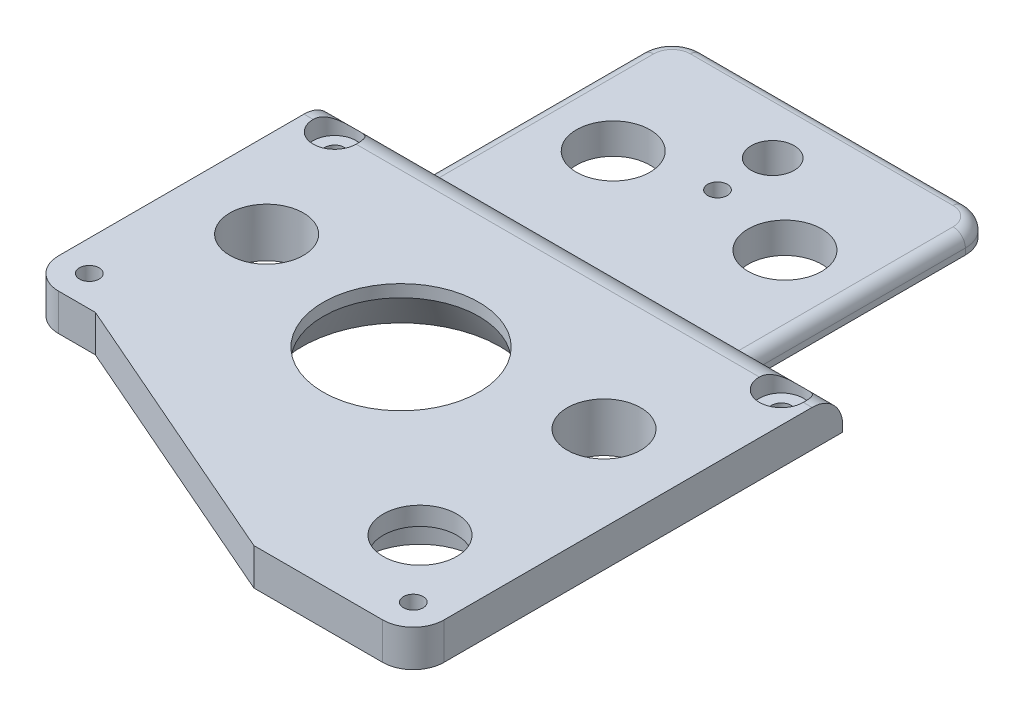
SolidWorks part; units mm, degrees
ref_plane "Спереди" through (0, 0, 0) normal (0, 0, 1) x (1, 0, 0)
ref_plane "Сверху" through (0, 0, 0) normal (0, 1, 0) x (1, 0, 0)
ref_plane "Справа" through (0, 0, 0) normal (1, 0, 0) x (0, 0, -1)
sketch "Sketch1" plane through (0, 0, 0) normal (0, 1, 0) x (1, 0, 0)
  line L0 (-26.4129, 15) -> (-26.4129, 55)
  line L1 (-26.4129, 55) -> (26.4129, 55)
  line L2 (26.4129, 55) -> (26.4129, 15)
  line L3 (26.4129, 15) -> (41.4129, 15)
  line L4 (41.4129, 15) -> (41.4129, -55)
  line L5 (41.4129, -55) -> (15.4129, -55)
  line L6 (15.4129, -55) -> (-30.4129, -35)
  line L7 (-30.4129, -35) -> (-41.4129, -35)
  line L8 (-41.4129, -35) -> (-41.4129, 15)
  line L9 (-41.4129, 15) -> (-26.4129, 15)
  dimension "D1" = 50
  dimension "D2" = 70
  dimension "D3" = 26
  dimension "D4" = 40
  dimension "D5" = 11
  dimension "D6" = 50
  dimension "D7" = 15
extrude "Boss-Extrude1" add sketch "Sketch1" along normal blind 3
sketch "Sketch2" plane through (0, 0, 0) normal (0, -1, 0) x (1, 0, 0)
  line L0 (-38.1629, 31.75) -> (-38.1629, -11.75)
  line L1 (-38.1629, -11.75) -> (-23.1629, -11.75)
  line L2 (-23.1629, -11.75) -> (-23.1629, -51.75)
  line L3 (-23.1629, -51.75) -> (23.1629, -51.75)
  line L4 (23.1629, -51.75) -> (23.1629, -11.75)
  line L5 (23.1629, -11.75) -> (38.1629, -11.75)
  line L6 (38.1629, -11.75) -> (38.1629, 51.75)
  line L7 (38.1629, 51.75) -> (16.0912, 51.75)
  line L8 (16.0912, 51.75) -> (-29.7346, 31.75)
  line L9 (-29.7346, 31.75) -> (-38.1629, 31.75)
  line L10 (-41.4129, 35) -> (-30.4129, 35) construction
  line L11 (-41.4129, -15) -> (-41.4129, 35) construction
  line L12 (-26.4129, -55) -> (-26.4129, -15) construction
  line L13 (26.4129, -55) -> (-26.4129, -55) construction
  line L14 (26.4129, -15) -> (26.4129, -55) construction
  line L15 (15.4129, 55) -> (41.4129, 55) construction
  line L18 (-30.4129, 35) -> (15.4129, 55) construction
  line L19 (41.4129, 55) -> (41.4129, -15) construction
  line L20 (-26.4129, -15) -> (-41.4129, -15) construction
  line L21 (41.4129, -15) -> (26.4129, -15) construction
  dimension "D1" = 3.25
  dimension "D2" = 3.25
  dimension "D3" = 3.25
  dimension "D4" = 3.25
  dimension "D5" = 3.25
  dimension "D6" = 3.25
  dimension "D7" = 3.25
  dimension "D8" = 3.25
  dimension "D9" = 3.25
  dimension "D10" = 3.25
extrude "Boss-Extrude2" add sketch "Sketch2" along normal blind 2
chamfer "Chamfer1" distance 2 angle 10 10 edges at (-33.9487, -2, 31.75) (-6.8217, -2, 41.75) (27.127, -2, 51.75) (38.1629, -2, 20) (30.6629, -2, -11.75) (23.1629, -2, -31.75) (0, -2, -51.75) (-23.1629, -2, -31.75) (-30.6629, -2, -11.75) (-38.1629, -2, 10)
sketch "Sketch3" plane through (0, 3, 0) normal (0, 1, 0) x (1, 0, 0)
  line L0 (-26.4129, 33) -> (26.4129, 33) construction
  line L1 (-26.4129, 55) -> (-26.4129, 15) construction
  line L2 (26.4129, 15) -> (26.4129, 55) construction
  line L3 (26.4129, 55) -> (-26.4129, 55) construction
  line L4 (0, 33) -> (0, 55) construction
  line L5 (-26.4129, 15) -> (26.4129, 15) construction
  line L6 (0, 15) -> (0, 55) construction
  line L7 (0, 30) -> (0, 40) construction
  line L8 (5, 30) -> (-5, 30) construction
  line L9 (5, 30) -> (5, 40) construction
  line L10 (5, 40) -> (-5, 40) construction
  line L11 (-5, 30) -> (-5, 40) construction
  line L12 (5, 30) -> (-5, 40) construction
  line L13 (5, 40) -> (-5, 30) construction
  circle A0 centre (-14, 33) radius 6
  circle A1 centre (14, 33) radius 6
  circle A2 centre (0, 45) radius 3.5
  circle A3 centre (0, 36) radius 1.6
  point P10 (0, 33)
  point P25 (0, 35)
  dimension "D1" = 28
  dimension "D2" = 12
  dimension "D5" = 7
  dimension "D9" = 3.2
  dimension "D3" = 14
  dimension "D4" = 22
  dimension "D6" = 10
  dimension "D7" = 15
  dimension "D8" = 10
  dimension "D10" = 4
extrude "Cut-Extrude1" cut sketch "Sketch3" against normal through all
sketch "Sketch4" plane through (0, 3, 0) normal (0, 1, 0) x (1, 0, 0)
  line L0 (-41.4129, 15) -> (41.4129, 15)
  line L1 (41.4129, 15) -> (41.4129, -55)
  line L2 (41.4129, -55) -> (15.4129, -55)
  line L3 (15.4129, -55) -> (-30.4129, -35)
  line L4 (-30.4129, -35) -> (-41.4129, -35)
  line L5 (-41.4129, -35) -> (-41.4129, 15)
extrude "Boss-Extrude3" add sketch "Sketch4" along normal blind 3
fillet "Fillet1" radius 5 1 edges at (0, 6, -15)
sketch "Sketch6" plane through (0, 6, 0) normal (0, 1, 0) x (1, 0, 0)
  line L0 (-41.4129, -15) -> (41.4129, -15) construction
  line L1 (-41.4129, 10) -> (-41.4129, -35) construction
  line L2 (41.4129, -55) -> (41.4129, 10) construction
  line L3 (15.4129, -55) -> (41.4129, -55) construction
  line L4 (-41.4129, -10) -> (41.4129, -10) construction
  line L5 (-41.4129, -35) -> (-30.4129, -35) construction
  line L6 (27.5, -10) -> (27.5, -55) construction
  circle A0 centre (-0.5871, -15) radius 12.7
  circle A1 centre (-27.5, -10) radius 6
  circle A2 centre (27.5, -10) radius 6
  circle A3 centre (27.5, -40) radius 6
  point P16 (0, -10)
  dimension "D1" = 25.4
  dimension "D4" = 12
  dimension "D9" = 12
  dimension "D2" = 42
  dimension "D3" = 40
  dimension "D5" = 55
  dimension "D6" = 27.5
  dimension "D7" = 25
  dimension "D8" = 30
extrude "Cut-Extrude3" cut sketch "Sketch6" against normal up to next
sketch "Sketch7" plane through (0, -2, 0) normal (0, -1, 0) x (1, 0, 0)
  circle A0 centre (27.5, 40) radius 9.5
  dimension "D2" = 19
extrude "Cut-Extrude4" cut sketch "Sketch7" against normal blind 5
chamfer "Chamfer2" distance 6 angle 30 1 edges at (-0.5871, -2, 2.3)
fillet "Fillet2" radius 5 4 edges at (-41.4129, 3, 35) (41.4129, 3, 55) (26.4129, 1.5, -55) (-26.4129, 1.5, -55)
fillet "Fillet3" radius 2 5 edges at (26.4129, 3, -32.2913) (24.9484, 3, -53.5355) (0, 3, -55) (-24.9484, 3, -53.5355) (-26.4129, 3, -32.2913)
sketch "Sketch9" plane through (0, 6, 0) normal (0, 1, 0) x (1, 0, 0)
  line L0 (15.4129, -55) -> (36.4129, -55) construction
  line L1 (41.4129, -50) -> (41.4129, 10) construction
  line L2 (-41.4129, 10) -> (-41.4129, -30) construction
  line L3 (-36.4129, -35) -> (-30.4129, -35) construction
  line L4 (-41.4129, 15) -> (-26.4129, 15) construction
  line L5 (26.4129, 15) -> (41.4129, 15) construction
  circle A0 centre (36.4129, -50) radius 1.6
  circle A1 centre (-36.4129, -30) radius 1.6
  circle A2 centre (36.4129, 10) radius 1.6
  circle A3 centre (-36.4129, 10) radius 1.6
  dimension "D1" = 3.2
  dimension "D2" = 5
  dimension "D3" = 5
  dimension "D4" = 5
  dimension "D5" = 5
  dimension "D6" = 5
  dimension "D7" = 5
  dimension "D8" = 5
  dimension "D9" = 5
extrude "Cut-Extrude5" cut sketch "Sketch9" against normal through all
sketch "Sketch10" plane through (0, 6, 0) normal (0, 1, 0) x (1, 0, 0)
  circle A0 centre (-36.4129, 10) radius 3.5
  circle A1 centre (36.4129, 10) radius 3.5843
  dimension "D1" = 7
extrude "Cut-Extrude6" cut sketch "Sketch10" against normal blind 3
sketch "Sketch11" plane through (0, -2, 0) normal (0, -1, 0) x (1, 0, 0)
  line L0 (-32.7629, -11.75) -> (-32.7629, -6.35)
  line L2 (-32.7629, -6.35) -> (-38.1629, -6.35)
  line L3 (-38.1629, -11.75) -> (-23.1629, -11.75) construction
  line L4 (-38.1629, -6.35) -> (-38.1629, -11.75)
  line L5 (-38.1629, -11.75) -> (-32.7629, -11.75)
  line L6 (-38.1629, 26.35) -> (-32.7629, 26.35)
  line L7 (-32.7629, 26.35) -> (-32.7629, 31.75)
  line L9 (-32.7629, 31.75) -> (-38.1629, 31.75)
  line L10 (-38.1629, 31.75) -> (-38.1629, 26.35)
  line L11 (-23.1629, -51.75) -> (-23.1629, -46.35)
  line L12 (-29.7346, 31.75) -> (-38.1629, 31.75) construction
  line L13 (-23.1629, -46.35) -> (-17.7629, -46.35)
  line L14 (-17.7629, -46.35) -> (-17.7629, -51.75)
  line L16 (-17.7629, -51.75) -> (-23.1629, -51.75)
  line L17 (23.1629, -51.75) -> (17.7629, -51.75)
  line L18 (17.7629, -51.75) -> (17.7629, -46.35)
  line L19 (17.7629, -46.35) -> (23.1629, -46.35)
  line L20 (38.1629, 51.75) -> (16.0912, 51.75) construction
  line L21 (23.1629, -46.35) -> (23.1629, -51.75)
  line L22 (38.1629, -11.75) -> (32.7629, -11.75)
  line L24 (32.7629, -11.75) -> (32.7629, -6.35)
  line L25 (32.7629, -6.35) -> (38.1629, -6.35)
  line L27 (38.1629, -6.35) -> (38.1629, -11.75)
  line L28 (38.1629, 46.35) -> (32.7629, 46.35)
  line L29 (32.7629, 46.35) -> (32.7629, 51.75)
  line L31 (32.7629, 51.75) -> (38.1629, 51.75)
  line L32 (38.1629, 51.75) -> (38.1629, 46.35)
  line L33 (38.1629, -11.75) -> (38.1629, 51.75) construction
  line L34 (-38.1629, 31.75) -> (-38.1629, -11.75) construction
  line L36 (23.1629, -51.75) -> (23.1629, -11.75) construction
  line L37 (-23.1629, -11.75) -> (-23.1629, -51.75) construction
  line L38 (23.1629, -11.75) -> (38.1629, -11.75) construction
  line L39 (-23.1629, -51.75) -> (23.1629, -51.75) construction
  dimension "D1" = 5.4
extrude "Cut-Extrude7" cut sketch "Sketch11" against normal up to surface (2 mm away)
